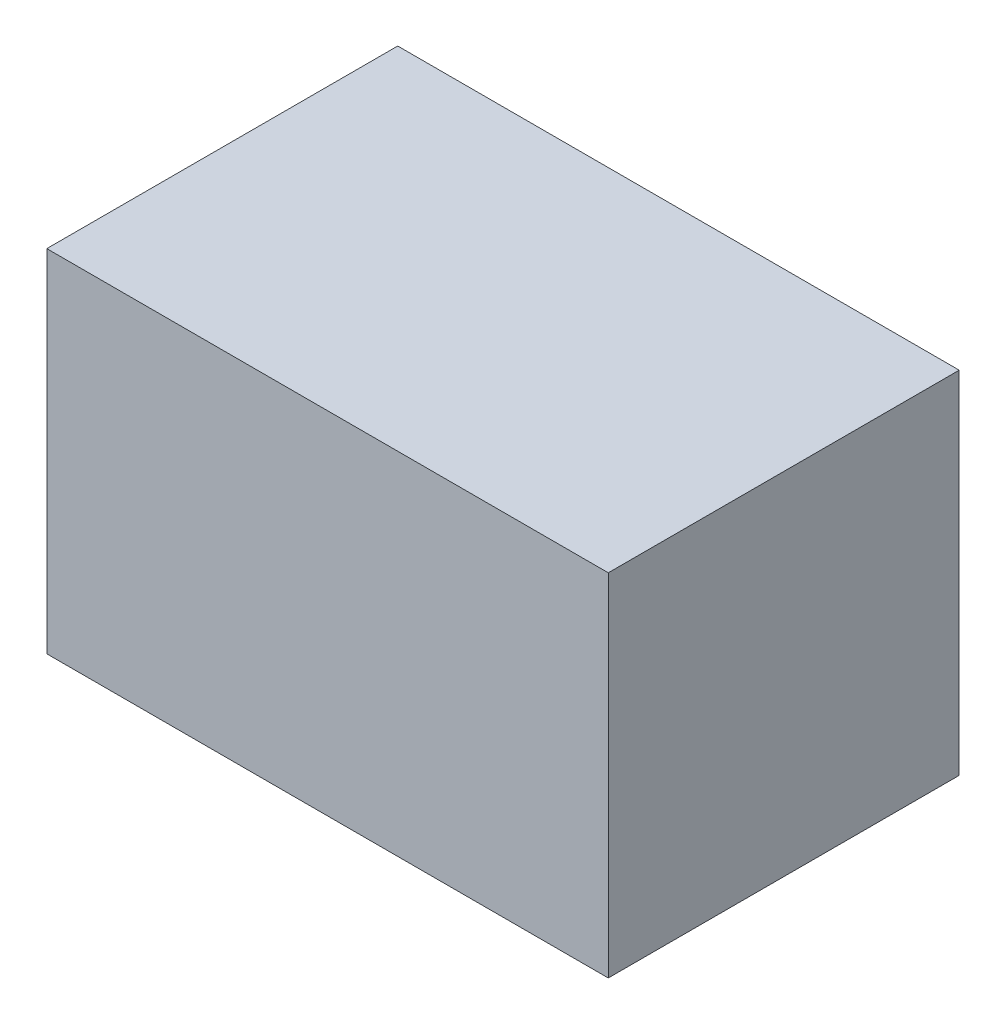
SolidWorks part; units mm, degrees
ref_plane "Front Plane" through (0, 0, 0) normal (0, 0, 1) x (1, 0, 0)
ref_plane "Top Plane" through (0, 0, 0) normal (0, 1, 0) x (1, 0, 0)
ref_plane "Right Plane" through (0, 0, 0) normal (1, 0, 0) x (0, 0, -1)
sketch "Sketch1" plane through (0, 0, 0) normal (0, 1, 0) x (1, 0, 0)
  line L1 (-40, -25) -> (40, -25)
  line L2 (-40, -25) -> (-40, 25)
  line L3 (-40, 25) -> (40, 25)
  line L4 (40, -25) -> (40, 25)
  line L5 (-40, -25) -> (40, 25) construction
  line L6 (-40, 25) -> (40, -25) construction
  point P0 (0, 0)
  dimension "D1" = 50
  dimension "D2" = 80
extrude "Boss-Extrude1" add sketch "Sketch1" along normal blind 50
shell "Shell1" thickness 5
sketch "Sketch2" plane through (0, 5, 0) normal (0, 1, 0) x (1, 0, 0)
  line L0 (-20, 11) -> (20, 11) construction
  line L1 (-20, 13) -> (20, 13)
  line L2 (-20, 9) -> (20, 9)
  line L3 (-20, -11) -> (20, -11) construction
  line L4 (-20, -9) -> (20, -9)
  line L5 (-20, -13) -> (20, -13)
  line L6 (0, 0) -> (-14.9474, 0) construction
  line L7 (-40, -25) -> (40, -25) construction
  arc A0 (-20, 13) -> (-20, 9) centre (-20, 11) ccw
  arc A1 (20, 9) -> (20, 13) centre (20, 11) ccw
  arc A2 (-20, -9) -> (-20, -13) centre (-20, -11) ccw
  arc A3 (20, -13) -> (20, -9) centre (20, -11) ccw
  point P2 (0, 11)
  point P7 (0, -11)
  dimension "D1" = 40
  dimension "D2" = 4
  dimension "D3" = 4
  dimension "D4" = 14
extrude "Boss-Extrude2" add sketch "Sketch2" along normal blind 5
